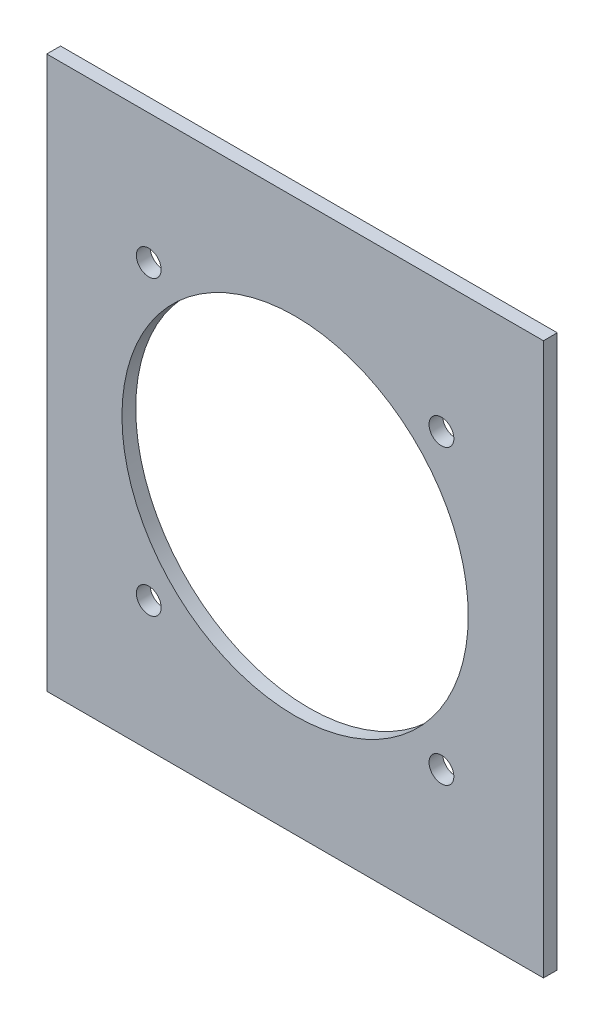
SolidWorks part; units mm, degrees
ref_plane "Face" through (0, 0, 0) normal (0, 0, 1) x (1, 0, 0)
ref_plane "Dessus" through (0, 0, 0) normal (0, 1, 0) x (1, 0, 0)
ref_plane "Droite" through (0, 0, 0) normal (1, 0, 0) x (0, 0, -1)
sketch "Esquisse1" plane through (0, 0, 0) normal (0, 0, 1) x (1, 0, 0)
  line L0 (0, 0) -> (0, 276.6557) construction
  line L1 (-180, 200) -> (180, 200)
  line L2 (-180, 200) -> (-180, -200)
  line L3 (-180, -200) -> (180, -200)
  line L4 (180, 200) -> (180, -200)
  circle A0 centre (0, 0) radius 125.5
  circle A1 centre (106.066, 106.066) radius 9
  circle A2 centre (-106.066, 106.066) radius 9
  circle A3 centre (-106.066, -106.066) radius 9
  circle A4 centre (106.066, -106.066) radius 9
  dimension "D5" = 251
  dimension "D14" = 18
  dimension "D15" = 18
  dimension "D16" = 18
  dimension "D17" = 18
  dimension "D1" = 400
  dimension "D2" = 360
  dimension "D3" = 180
  dimension "D4" = 200
  dimension "D6" = 150
  dimension "D7" = 150
  dimension "D8" = 150
  dimension "D9" = 150
  dimension "D10" = 45
  dimension "D11" = 45
  dimension "D12" = 45
  dimension "D13" = 45
extrude "Extrusion1" add sketch "Esquisse1" along normal blind 10
